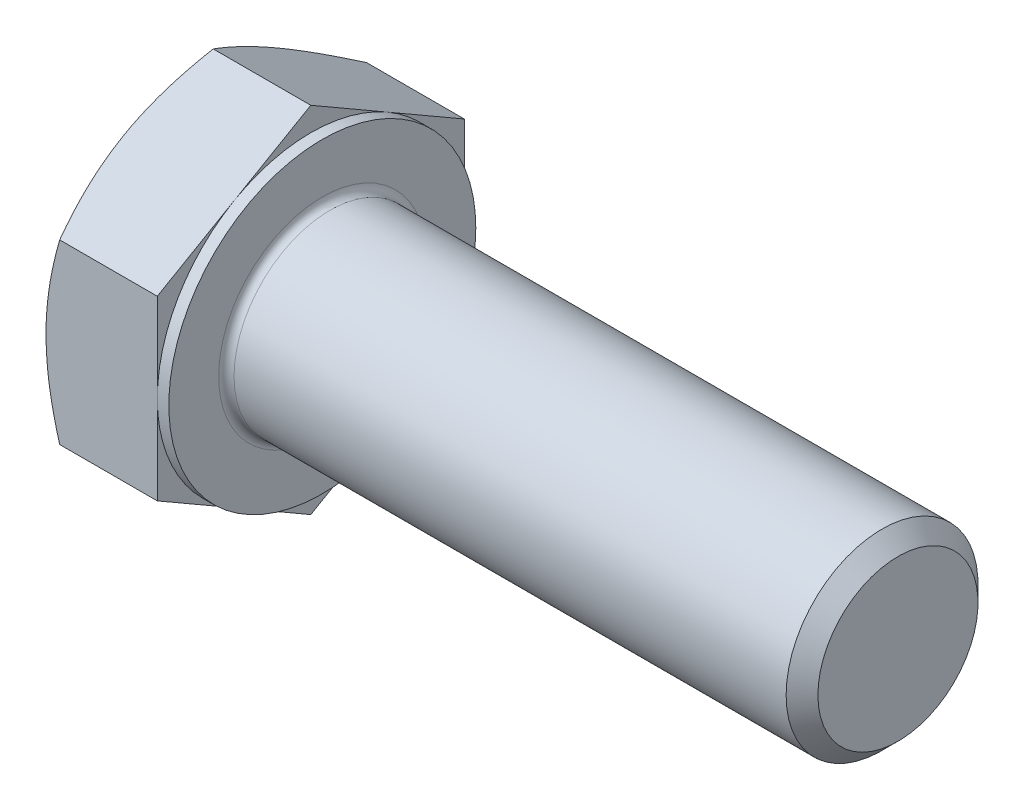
SolidWorks part; units mm, degrees
ref_plane "Plane1" through (0, 0, 0) normal (0, 0, 1) x (1, 0, 0)
ref_plane "Plane2" through (0, 0, 0) normal (0, 1, 0) x (1, 0, 0)
ref_plane "Plane3" through (0, 0, 0) normal (1, 0, 0) x (0, 0, -1)
extrude "BaseHead" add sketch "Sketch1" along normal blind 6.4
sketch "Sketch1" plane through (0, 0, 0) normal (1, 0, 0) x (0, 0, -1)
  line L0 (8, 4.6188) -> (8, -4.6188)
  line L1 (-8, 4.6188) -> (-8, -4.6188)
  line L2 (8, -4.6188) -> (0, -9.2376)
  line L3 (0, -9.2376) -> (-8, -4.6188)
  line L4 (8, 4.6188) -> (0, 9.2376)
  line L5 (0, 9.2376) -> (-8, 4.6188)
  dimension "Width_flats" = 16
  dimension "D2" = 120
  dimension "D3" = 8
  dimension "D4" = 8
  dimension "D5" = 8
revolve "BearingFace" cut sketch "Sketch4"
sketch "Sketch4"
  line L1 (6.4, 9.2376) -> (6.4, 4.6188) construction
  line L2 (6.4, 8) -> (5.8, 8)
  line L3 (6.4, 8) -> (6.4, 19.2376)
  line L4 (6.4, 19.2376) -> (5.8, 19.2376)
  line L5 (0, 0) -> (95.25, 0) construction
  line L6 (0, 0) -> (96.52, 0) construction
  line L7 (5.8, 8) -> (5.8, 19.2376)
  line L8 (6.4, 9.2376) -> (0.7145, 9.2376) construction
revolve "HeadChamfer" cut sketch "Sketch3" angle 360 about L6
sketch "Sketch3" plane through (0, 0, 0) normal (0, 0, 1) x (1, 0, 0)
  line L0 (0, 8) -> (3.6013, 14.2376)
  line L1 (0, 9.2376) -> (0, 4.6188) construction
  line L2 (3.6013, 14.2376) -> (3.6013, 19.2376)
  line L3 (3.6013, 19.2376) -> (-10, 19.2376)
  line L4 (-10, 19.2376) -> (-10, 8)
  line L5 (-10, 8) -> (0, 8)
  line L6 (0, 0) -> (99.06, 0) construction
  line L7 (6.4, 9.2376) -> (0, 9.2376) construction
  dimension "D1" = 8
  dimension "D2" = 5
  dimension "D3" = 10
  dimension "D4" = 5
  dimension "Head_ch_ang" = 30
sketch "BodySke" plane through (0, 0, 0) normal (0, 0, 1) x (1, 0, 0)
  line L0 (0, 4.6188) -> (0, -4.6188) construction
  line L1 (0, 0) -> (36.4, 0)
  line L2 (0, 0) -> (0, 5)
  line L3 (0, 5) -> (35.572, 5)
  line L4 (36.4, 0) -> (36.4, 4.172)
  line L5 (6.4, 9.2376) -> (6.4, 4.6188) construction
  line L6 (36.4, 4.172) -> (35.572, 5)
  line L7 (0, 0) -> (96.52, 0) construction
  line L8 (36.4, -4.172) -> (35.572, -5) construction
  line L9 (0, -5) -> (35.572, -5) construction
  line L10 (7.9, 15.24) -> (7.9, -1.27) construction
  line L12 (6.4, 4.6188) -> (6.4, -4.6188) construction
  dimension "Length" = 30
  dimension "Body_ch_ang" = 45
  dimension "Diameter" = 10
  dimension "Minor_dia" = 8.344
  dimension "Advance" = 1.5
revolve "BaseBody" add sketch "BodySke"
fillet "HeadFillet" radius 0.4 1 edges at (6.4, 0, -5)
sketch "ThdSchSke" plane through (0, 0, 0) normal (0, 0, 1) x (1, 0, 0)
  line L0 (7.9, -4.172) -> (7.3202, -5)
  line L1 (7.9, -4.172) -> (8.4798, -5)
  line L2 (8.4798, -5) -> (8.4798, -6.25)
  line L3 (-3.175, 0) -> (5.1513, 0) construction
  line L5 (8.4798, -6.25) -> (7.3202, -6.25)
  line L6 (7.3202, -6.25) -> (7.3202, -5)
  dimension "Thread_minor" = 8.344
  dimension "Diameter" = 10
  dimension "Start" = 7.9
  dimension "SideAngle" = 55
  dimension "VeeAngle" = 70
  dimension "Overcut" = 12.5
revolve "ThreadSchematic" cut sketch "ThdSchSke" angle 360 about L3
pattern_linear "ThdSchPat"
equation "\"D3@Sketch1\" = \"Width_flats@Sketch1\" / 2"
equation "\"D4@Sketch1\" = \"D3@Sketch1\""
equation "\"D5@Sketch1\" = \"D4@Sketch1\""
equation "\"Thread_minor@ThreadCosmetic\" = \"Minor_dia@BodySke\""
equation "\"D1@Sketch3\" = \"Width_flats@Sketch1\" / 2"
equation "\"D1@Sketch4\" = \"Width_flats@Sketch1\""
equation "\"Thread_length@ThreadCosmetic\" = \"Length@BodySke\" - \"Advance@BodySke\""
equation "\"Thread_minor@ThdSchSke\" = \"Minor_dia@BodySke\""
equation "\"Diameter@ThdSchSke\" = \"Diameter@BodySke\""
equation "\"Overcut@ThdSchSke\" = \"Diameter@BodySke\" * 1.25"
equation "\"Start@ThdSchSke\" = \"Head_ht@BaseHead\" + \"Length@BodySke\" - \"Thread_length@ThreadCosmetic\"  '---Non-countersunk---"
equation "\"Num_threads@ThdSchPat\" = int( \"Thread_length@ThreadCosmetic\" / \"Advance@BodySke\" + 0.999 )  + 1"
equation "\"Advance@ThdSchPat\" = \"Thread_length@ThreadCosmetic\" /  (\"Num_threads@ThdSchPat\" - 1) 'relax it"
equation "\"Num_threads@ThdSchPat\" = \"Num_threads@ThdSchPat\" - sgn( \"Num_threads@ThdSchPat\" - 1) '---chamfered tips only---"
